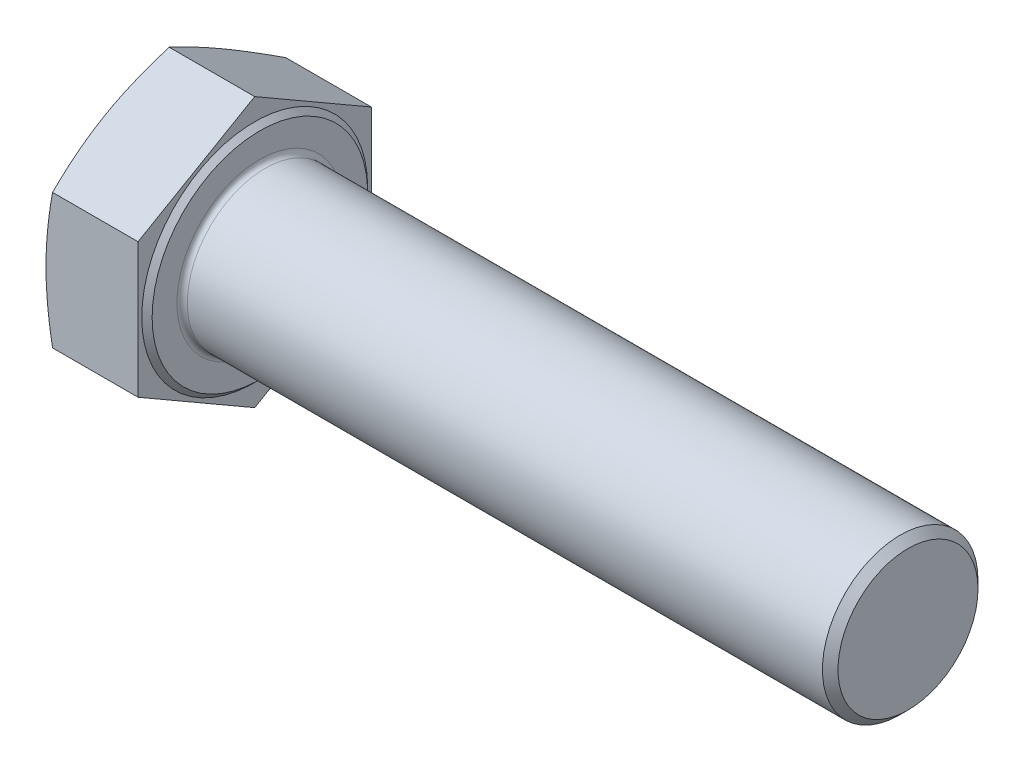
SolidWorks part; units mm, degrees
ref_plane "Front" through (0, 0, 0) normal (0, 0, 1) x (1, 0, 0)
ref_plane "Top" through (0, 0, 0) normal (0, 1, 0) x (1, 0, 0)
ref_plane "Right" through (0, 0, 0) normal (1, 0, 0) x (0, 0, -1)
sketch "Sketch2" plane through (0, 0, 0) normal (1, 0, 0) x (0, 0, -1)
  line L1 (0, -20.7846) -> (18, -10.3923)
  line L2 (18, -10.3923) -> (18, 10.3923)
  line L3 (18, 10.3923) -> (0, 20.7846)
  line L4 (0, 20.7846) -> (-18, 10.3923)
  line L5 (-18, 10.3923) -> (-18, -10.3923)
  line L6 (-18, -10.3923) -> (0, -20.7846)
  circle A0 centre (0, 0) radius 18 construction
  dimension "s" = 36
extrude "BaseHead" add sketch "Sketch2" along normal blind 15
sketch "Sketch3" plane through (0, 0, 0) normal (0, 0, 1) x (1, 0, 0)
  line L0 (15, 20.7846) -> (15, 16.625)
  line L2 (15, 16.625) -> (14.2, 17.425)
  line L3 (14.2, 17.425) -> (14.2, 20.7846)
  line L5 (14.2, 20.7846) -> (15, 20.7846)
  line L6 (-0.9571, 0) -> (7.6478, 0) construction
  line L7 (15, 20.7846) -> (0, 20.7846) construction
  dimension "D1" = 45
  dimension "c" = 0.8
  dimension "dw" = 33.25
revolve "BearingFace" cut sketch "Sketch3" angle 360 about L6
sketch "Sketch4" plane through (0, 0, 0) normal (0, 0, 1) x (1, 0, 0)
  line L0 (-0.4935, 0) -> (3.5626, 0) construction
  line L2 (0, 20.7846) -> (1.0135, 20.7846)
  line L4 (1.0135, 20.7846) -> (0, 18)
  line L6 (0, 18) -> (0, 20.7846)
  line L7 (14.2, 20.7846) -> (0, 20.7846) construction
  dimension "D1" = 20
  dimension "D2" = 36
revolve "HeadChamfer" cut sketch "Sketch4" angle 360 about L0
ref_plane "Plane1" through (61, 0, 0) normal (1, 0, 0) x (0, 0, -1)
sketch "Sketch5" plane through (15, 0, 0) normal (1, 0, 0) x (0, 0, -1)
  circle A0 centre (0, 0) radius 12
  dimension "d" = 24
extrude "BaseBody" add sketch "Sketch5" along normal blind 100
chamfer "Chamfer1" distance 1.2 angle 45 1 edges at (115, 0, -12)
fillet "HeadFillet" radius 0.8 1 edges at (15, 0, -12)
equation "\"D2@Sketch4\" = \"s@Sketch2\""
equation "\"D1@Chamfer1\" = 0.05 * \"d@Sketch5\""
equation "\"D1@ThreadCosmetic1\" = \"l@BaseBody\" - \"lg@Plane1\""
